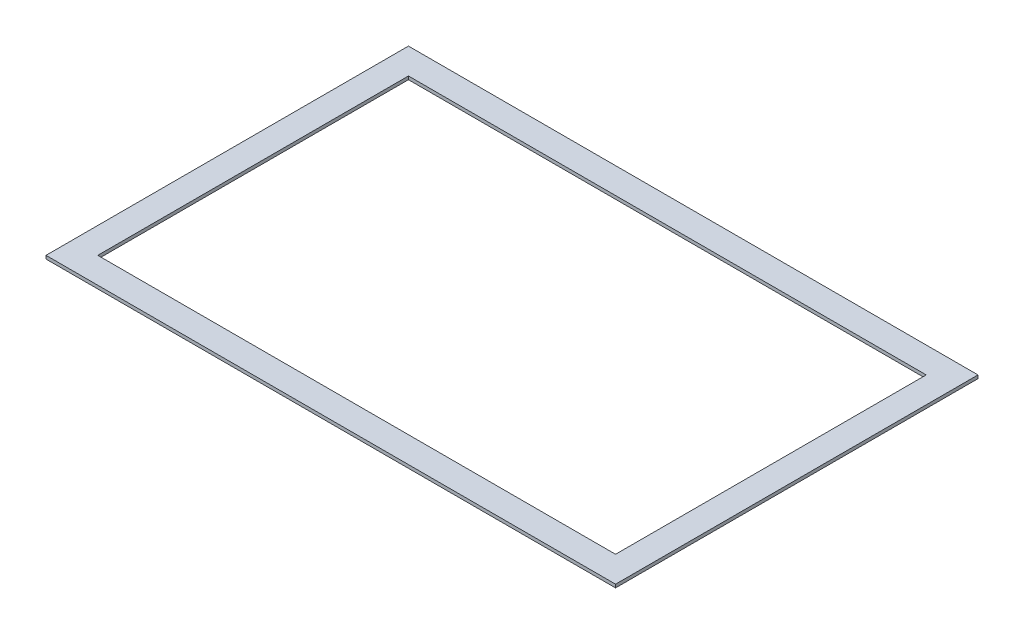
SolidWorks part; units mm, degrees
ref_plane "Front Plane" through (0, 0, 0) normal (0, 0, 1) x (1, 0, 0)
ref_plane "Top Plane" through (0, 0, 0) normal (0, 1, 0) x (1, 0, 0)
ref_plane "Right Plane" through (0, 0, 0) normal (1, 0, 0) x (0, 0, -1)
sketch "Sketch1" plane through (0, 0, 0) normal (0, 1, 0) x (1, 0, 0)
  line L0 (-12.7, -12.7) -> (266.7, -12.7)
  line L1 (0, 0) -> (254, 0)
  line L2 (0, 0) -> (0, 152.4)
  line L3 (0, 152.4) -> (254, 152.4)
  line L4 (254, 0) -> (254, 152.4)
  line L5 (266.7, -12.7) -> (266.7, 165.1)
  line L6 (-12.7, 165.1) -> (266.7, 165.1)
  line L7 (-12.7, -12.7) -> (-12.7, 165.1)
  dimension "D1" = 152.4
  dimension "D2" = 254
  dimension "D3" = 12.7
extrude "Extrude1" add sketch "Sketch1" along normal blind 1.6002
